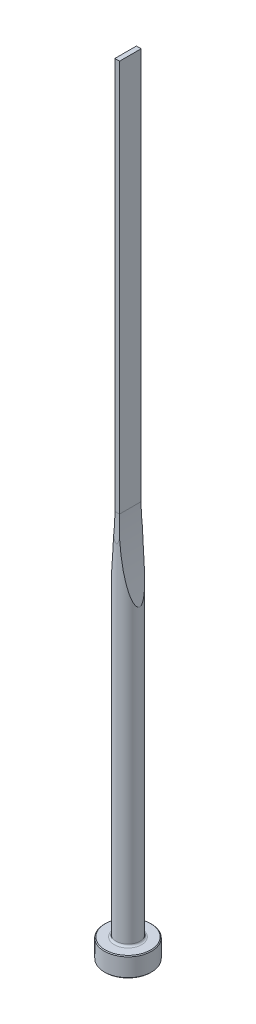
SolidWorks part; units mm, degrees
ref_plane "Front Plane" through (0, 0, 0) normal (0, 0, 1) x (1, 0, 0)
ref_plane "Top Plane" through (0, 0, 0) normal (0, 1, 0) x (1, 0, 0)
ref_plane "Right Plane" through (0, 0, 0) normal (1, 0, 0) x (0, 0, -1)
sketch "Sketch1" plane through (0, 0, 0) normal (0, 0, 1) x (1, 0, 0)
  line L0 (0, 0) -> (5.8, 0)
  line L1 (55, 0) -> (-55, 0) construction
  line L2 (6, 0.2) -> (6, 4.8)
  line L3 (5.8, 5) -> (3.5, 5)
  line L4 (3, 5.5) -> (3, 200)
  line L5 (0, 200) -> (3, 200)
  line L6 (6, 4.8) -> (5.8, 5)
  line L7 (5.8, 0) -> (6, 0.2)
  line L8 (0, 200) -> (0, 0)
  arc A0 (3, 5.5) -> (3.5, 5) centre (3.5, 5.5) ccw
  point P1 (6, 0)
  point P6 (6, 5)
  dimension "D4" = 0.5
  dimension "D1" = 3
  dimension "D2" = 6
  dimension "D3" = 5
  dimension "D5" = 200
revolve "Revolve1" add sketch "Sketch1" angle 360 about L8
sketch "Sketch2" plane through (0, 0, 0) normal (0, 0, 1) x (1, 0, 0)
  line L0 (0.6, 200) -> (0.6, 100)
  line L1 (3, 200) -> (-3, 200) construction
  line L2 (-0.6, 200) -> (-0.6, 100)
  line L3 (3, 200) -> (3, 79.3544)
  line L4 (-3, 200) -> (-3, 79.3544)
  line L5 (0, -6.6) -> (0, 6.6) construction
  line L6 (3, 200) -> (0.6, 200)
  line L8 (-0.6, 200) -> (-3, 200)
  arc A0 (0.6, 100) -> (3, 79.3544) centre (90.6, 100) ccw
  arc A1 (-0.6, 100) -> (-3, 79.3544) centre (-90.6, 100) cw
  dimension "D4" = 90
  dimension "D1" = 100
  dimension "D2" = 1.2
  dimension "D3" = 0.6
extrude "Cut-Extrude1" cut sketch "Sketch2" against normal mid plane 10
sketch "Sketch3" plane through (0, 0, 0) normal (1, 0, 0) x (0, 0, -1)
  line L0 (2.75, 200) -> (2.75, 100)
  line L1 (-2.9394, 200) -> (2.9394, 200) construction
  line L2 (-2.75, 200) -> (-2.75, 100)
  line L3 (3, 200) -> (3, 93.2965)
  line L4 (2.75, 200) -> (3, 200)
  line L5 (0, 6.6) -> (0, -6.6) construction
  line L6 (-3, 200) -> (-3, 93.2965)
  line L8 (-2.75, 200) -> (-3, 200)
  arc A0 (2.75, 100) -> (3, 93.2965) centre (92.75, 100) ccw
  arc A1 (-2.75, 100) -> (-3, 93.2965) centre (-92.75, 100) cw
  dimension "D2" = 90
  dimension "D1" = 100
  dimension "D3" = 5.5
  dimension "D4" = 2.75
extrude "Cut-Extrude2" cut sketch "Sketch3" against normal mid plane 10
